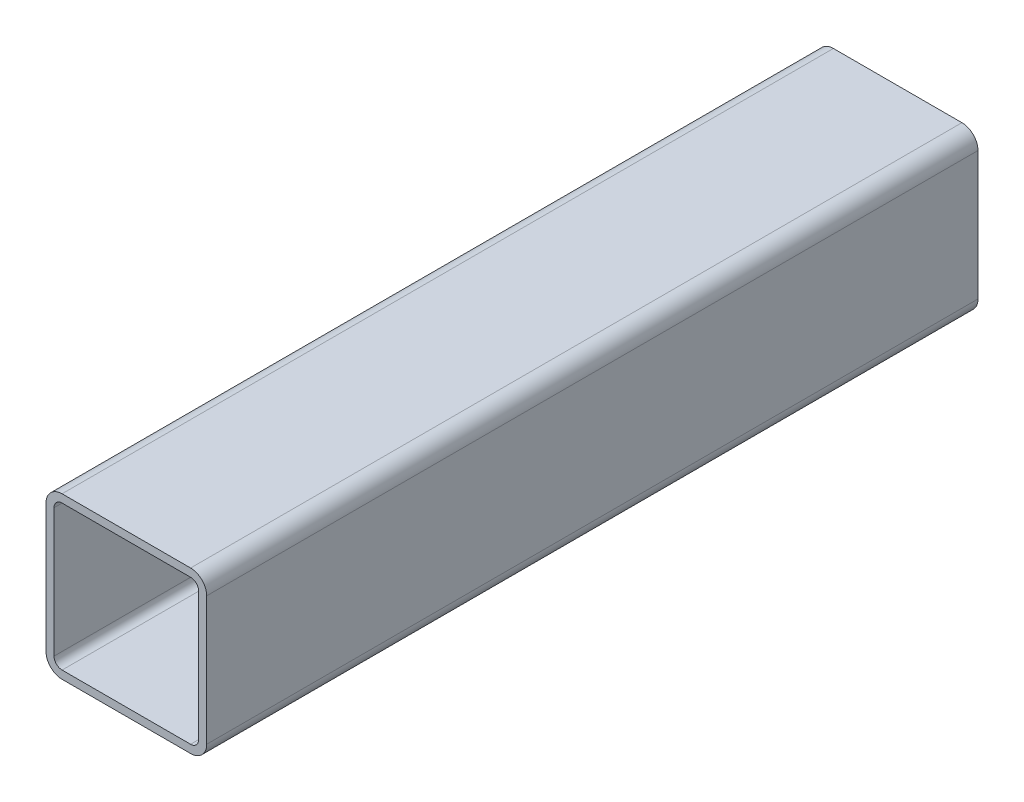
SolidWorks part; units mm, degrees
ref_plane "Front Plane" through (0, 0, 0) normal (0, 0, 1) x (1, 0, 0)
ref_plane "Top Plane" through (0, 0, 0) normal (0, 1, 0) x (1, 0, 0)
ref_plane "Right Plane" through (0, 0, 0) normal (1, 0, 0) x (0, 0, -1)
sketch "Sketch1" plane through (0, 0, 0) normal (0, 0, 1) x (1, 0, 0)
sketch_block_instance "HSS2.5x2.5x0.125-1"
sketch_block "HSS2.5x2.5x0.125"
extrude "Boss-Extrude1" add sketch "Sketch1" along normal blind 304.8
